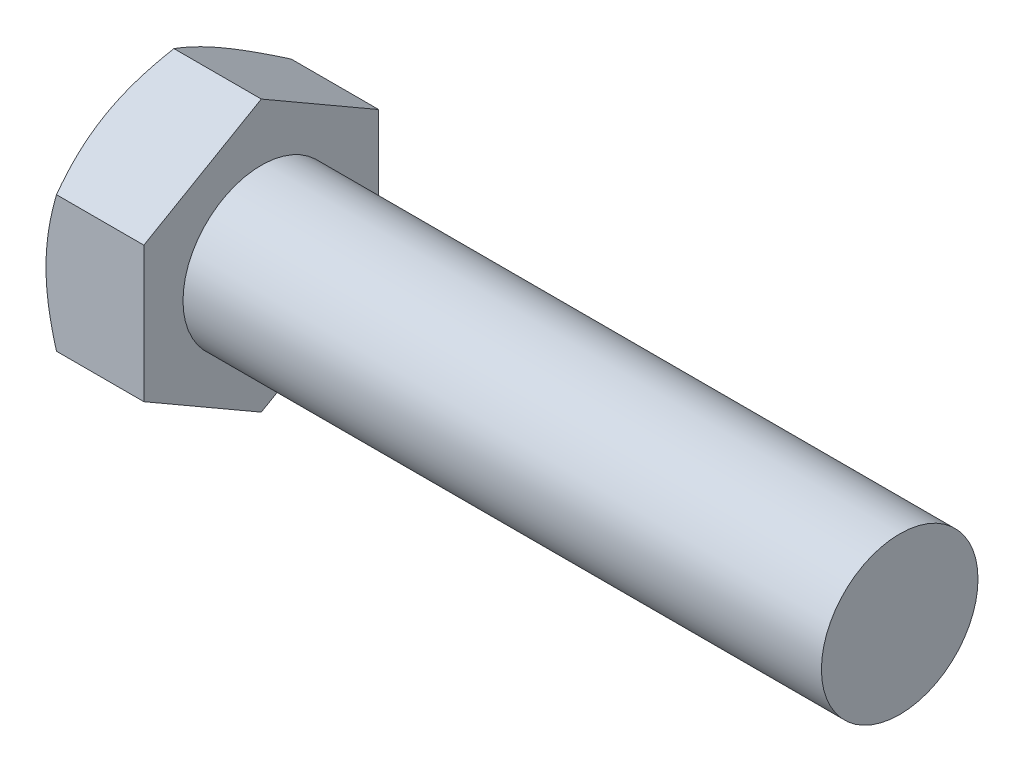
SolidWorks part; units mm, degrees
ref_plane "Face" through (0, 0, 0) normal (0, 0, 1) x (1, 0, 0)
ref_plane "Dessus" through (0, 0, 0) normal (0, 1, 0) x (1, 0, 0)
ref_plane "Droite" through (0, 0, 0) normal (1, 0, 0) x (0, 0, -1)
imported_body "Importée1"
sketch "Esquisse1" plane through (0, 0, 0) normal (0, 1, 0) x (1, 0, 0)
  line L0 (48.9326, 10.4395) -> (48.9326, -17.0546)
extrude "Enlèv. mat.-Extru.1" cut sketch "Esquisse1" against normal through all and the other way through all
